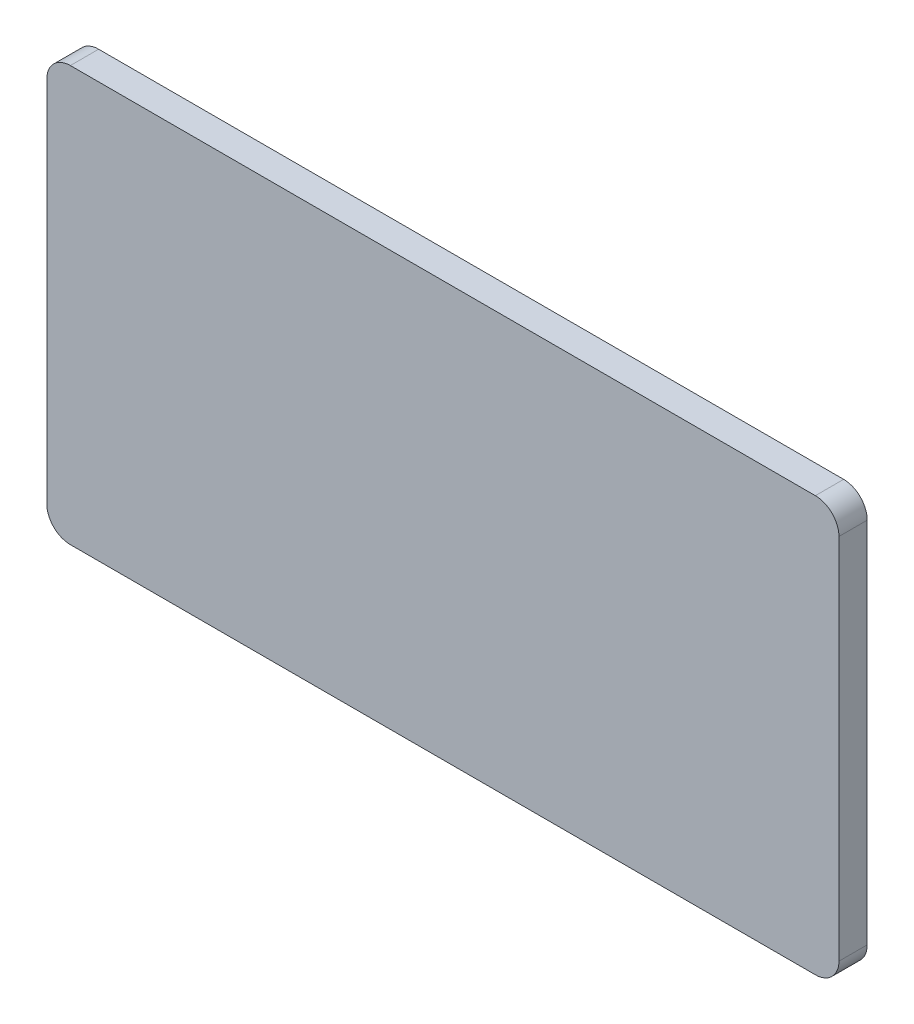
SolidWorks part; units mm, degrees
ref_plane "Plan de face" through (0, 0, 0) normal (0, 0, 1) x (1, 0, 0)
ref_plane "Plan de dessus" through (0, 0, 0) normal (0, 1, 0) x (1, 0, 0)
ref_plane "Plan de droite" through (0, 0, 0) normal (1, 0, 0) x (0, 0, -1)
sketch "Esquisse1" plane through (0, 0, 0) normal (0, 0, 1) x (1, 0, 0)
  line L0 (75.1067, 0) -> (-56.1865, 0) construction
  line L1 (75.1067, 114) -> (-56.1865, 114) construction
  line L2 (0, -4.9573) -> (0, 128.4779) construction
  line L4 (-50, -15.4988) -> (-50, 135.6333) construction
  line L9 (-38, 74.5) -> (-38, 64.1524) construction
  line L17 (-39.5, 107) -> (39.5, 107)
  line L18 (-42, 104.5) -> (-42, 65.5)
  line L19 (-39.5, 63) -> (39.5, 63)
  line L21 (42, 104.5) -> (42, 65.5)
  line L22 (-27.8545, 67) -> (-40.6187, 67) construction
  line L24 (75.1067, -6) -> (-56.1865, -6) construction
  line L31 (-40.6187, 103) -> (-27.8545, 103) construction
  line L32 (-39, 105.664) -> (-39, 92.0576) construction
  arc A4 (-42, 104.5) -> (-39.5, 107) centre (-39.5, 104.5) cw
  arc A5 (-42, 65.5) -> (-39.5, 63) centre (-39.5, 65.5) ccw
  arc A6 (39.5, 63) -> (42, 65.5) centre (39.5, 65.5) ccw
  arc A7 (42, 104.5) -> (39.5, 107) centre (39.5, 104.5) ccw
  dimension "D14" = 4
  dimension "D15" = 6
  dimension "D18" = 4
  dimension "D2" = 2.5
  dimension "D1" = 114
  dimension "D9" = 84
  dimension "D10" = 44
  dimension "D13" = 4
  dimension "D19" = 3
extrude "Boss.-Extru.1" add sketch "Esquisse1" along normal blind 3
sketch "Esquisse2" plane through (0, 0, 0) normal (0, 0, -1) x (-1, 0, 0)
  line L0 (-33.9, 100.4) -> (33.9, 100.4)
  line L1 (-36.4, 97.9) -> (-36.4, 76.9)
  line L2 (-33.9, 74.4) -> (33.9, 74.4)
  line L3 (36.4, 97.9) -> (36.4, 76.9)
  line L4 (-39.5, 107) -> (39.5, 107) construction
  line L5 (-42, 65.5) -> (-42, 104.5) construction
  arc A0 (33.9, 100.4) -> (36.4, 97.9) centre (33.9, 97.9) cw
  arc A1 (33.9, 74.4) -> (36.4, 76.9) centre (33.9, 76.9) ccw
  arc A2 (-36.4, 76.9) -> (-33.9, 74.4) centre (-33.9, 76.9) ccw
  arc A3 (-33.9, 100.4) -> (-36.4, 97.9) centre (-33.9, 97.9) ccw
  dimension "D5" = 2.5
  dimension "D1" = 26
  dimension "D2" = 72.8
  dimension "D3" = 6.6
  dimension "D4" = 5.6
extrude "Boss.-Extru.2" add sketch "Esquisse2" along normal blind 3
